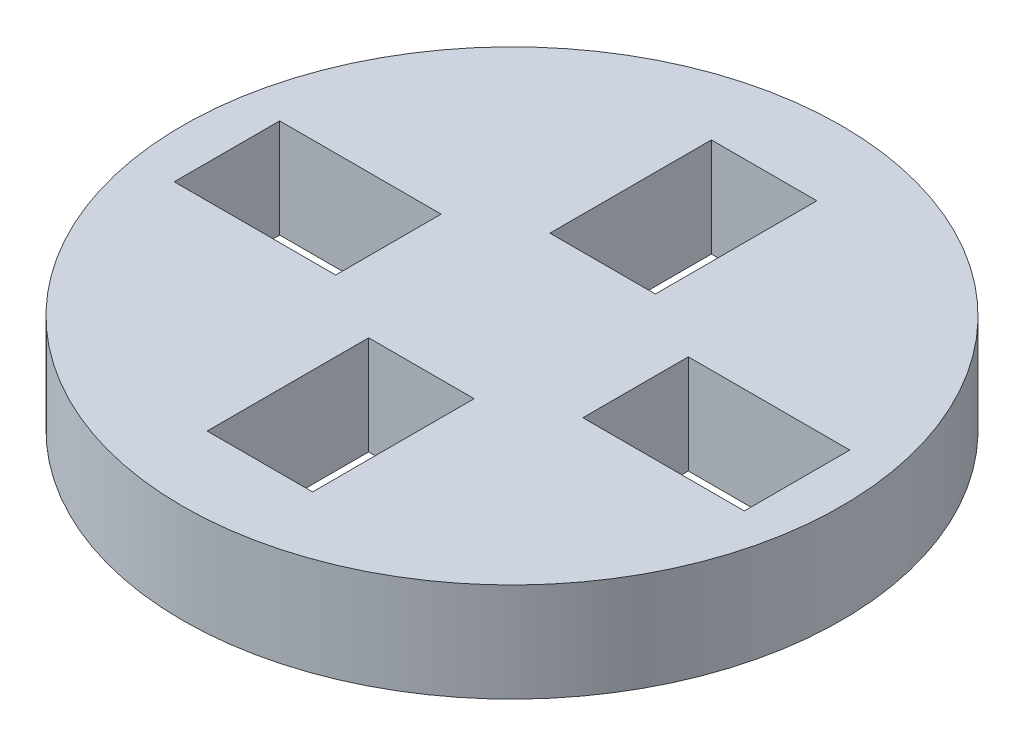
SolidWorks part; units mm, degrees
ref_plane "Front Plane" through (0, 0, 0) normal (0, 0, 1) x (1, 0, 0)
ref_plane "Top Plane" through (0, 0, 0) normal (0, 1, 0) x (1, 0, 0)
ref_plane "Right Plane" through (0, 0, 0) normal (1, 0, 0) x (0, 0, -1)
sketch "Sketch1" plane through (0, 0, 0) normal (0, 1, 0) x (1, 0, 0)
  line L0 (-26.7373, 0) -> (22.3356, 0) construction
  line L5 (0, 20.4728) -> (0, -17.7228) construction
  line L7 (3.75, 1.6) -> (8.65, 1.6)
  line L8 (3.75, 1.6) -> (3.75, -1.6)
  line L9 (3.75, -1.6) -> (8.65, -1.6)
  line L10 (8.65, 1.6) -> (8.65, -1.6)
  line L11 (-1.6, 7.65) -> (1.6, 7.65)
  line L12 (-1.6, 7.65) -> (-1.6, 2.75)
  line L13 (-1.6, 2.75) -> (1.6, 2.75)
  line L14 (1.6, 7.65) -> (1.6, 2.75)
  line L15 (-3.75, 1.6) -> (-8.65, 1.6)
  line L16 (-3.75, 1.6) -> (-3.75, -1.6)
  line L17 (-3.75, -1.6) -> (-8.65, -1.6)
  line L18 (-8.65, 1.6) -> (-8.65, -1.6)
  line L19 (-1.6, -2.75) -> (1.6, -2.75)
  line L20 (-1.6, -2.75) -> (-1.6, -7.65)
  line L21 (-1.6, -7.65) -> (1.6, -7.65)
  line L22 (1.6, -2.75) -> (1.6, -7.65)
  circle A0 centre (0, 0) radius 10
  point P24 (0, 2.75)
  point P25 (0, -2.75)
extrude "Boss-Extrude1" add sketch "Sketch1" along normal blind 3
equation "\"mdf\" = ( \"kerf\" ) + 3mm'chess table material"
equation "\"diameter\"= 20mm'diameter of all of the pieces in relation with the chess table"
equation "\"size press fit\"= 4.9mm"
equation "\"D4@Sketch1\"=\"mdf\""
equation "\"D2@Sketch1\"=\"mdf\""
equation "\"D3@Sketch1\"=\"mdf\""
equation "\"D1@Sketch1\"=\"diameter\""
equation "\"D5@Sketch1\"=\"mdf\""
equation "\"D7@Sketch1\"=\"size press fit\""
equation "\"D8@Sketch1\"=\"size press fit\""
equation "\"D13@Sketch1\"=\"size press fit\""
equation "\"D14@Sketch1\"=\"size press fit\""
equation "\"gap\"= ( \"diameter\" - ( \"size press fit\" * 3 ) ) / 4mm"
equation "\"gap press fit\"= \"diameter\" - \"size press fit\" - \"size press fit\" - \"gap\" - \"gap\""
equation "\"gap y\"= \"gap\" + 1mm"
equation "\"kerf\"= 0.2"
